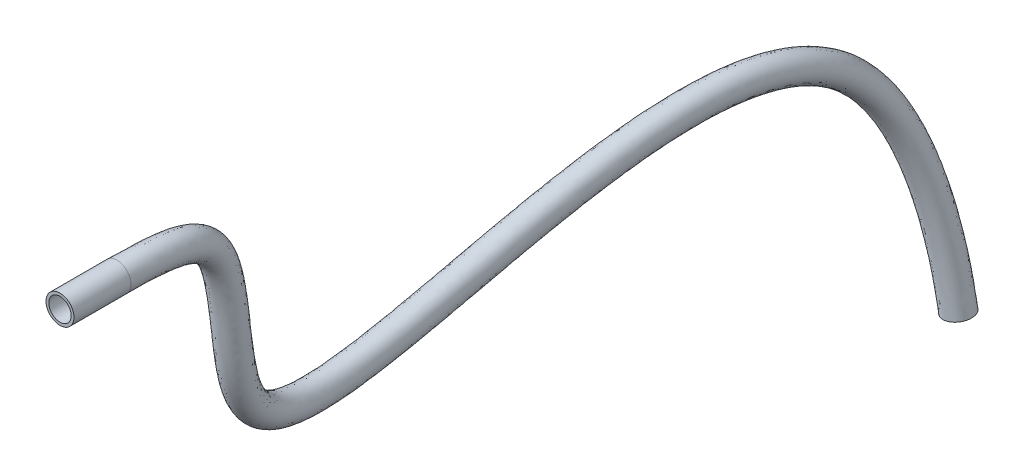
SolidWorks part; units mm, degrees
ref_plane "Front Plane" through (0, 0, 0) normal (0, 0, 1) x (1, 0, 0)
ref_plane "Top Plane" through (0, 0, 0) normal (0, 1, 0) x (1, 0, 0)
ref_plane "Right Plane" through (0, 0, 0) normal (1, 0, 0) x (0, 0, -1)
sketch "Sketch1" plane through (0, 0, 0) normal (0, 0, 1) x (1, 0, 0)
  circle A0 centre (0, 0) radius 2
  circle A1 centre (0, 0) radius 2.5
  dimension "D1" = 4
  dimension "D2" = 0.5
sketch3d "3DSketch1"
  line L0 (0, 0, 0) -> (0, 0, -10.2115)
  circle A0 centre (7.6909, -70.6189, -152.3544) radius 2 construction
  spline S0 degree 3 poles (0, 0, -10.2115) (0.2536, 0.206, -21.1799) (-0.3048, -2.938, -30.7412) (0.5501, -24.3803, -29.7014) (-2.5776, -51.9172, -45.3551) (-6.7082, -1.0277, -145.3252) (6.2703, -59.1376, -151.9008) (7.9519, -72.6148, -152.4447) knots 0 0 0 0 0.115875 0.241858 0.309602 0.793322 1 1 1 1
  point P25 (7.4453, -68.6347, -152.3029)
sweep "Sweep1" add profiles "Sketch1" path "3DSketch1"
ref_plane "Plane1" through (-4.9184, -90.9882, 49.6085) normal (0.9809, -0.174, -0.0872) x (-0.1746, -0.9846, 0)
sketch "Sketch2" plane through (-4.9184, -90.9882, 49.6085) normal (0.9809, -0.174, -0.0872) x (-0.1746, -0.9846, 0)
  line L0 (-41.2069, 85.1986) -> (-82.6196, 85.1986) construction
  line L1 (-41.2069, 85.1986) -> (-41.2069, 148.214) construction
  circle A0 centre (-56.3791, 87.1849) radius 0.1
  dimension "D2" = 0.2
  dimension "D3" = 15.1722
  dimension "D1" = 1.9863
extrude "Boss-Extrude1" add sketch "Sketch2" along normal blind 3
